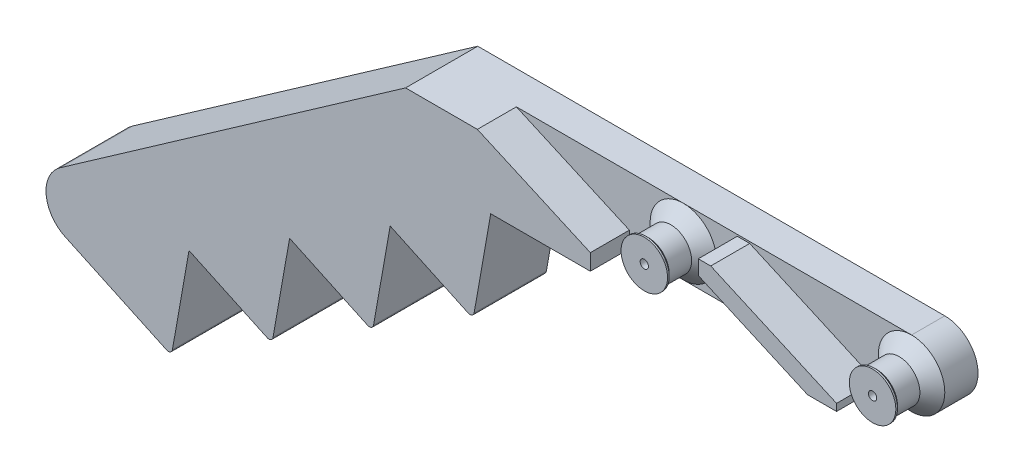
SolidWorks part; units mm, degrees
ref_plane "Alzado" through (0, 0, 0) normal (0, 0, 1) x (1, 0, 0)
ref_plane "Planta" through (0, 0, 0) normal (0, 1, 0) x (1, 0, 0)
ref_plane "Vista lateral" through (0, 0, 0) normal (1, 0, 0) x (0, 0, -1)
sketch "Sketch1" plane through (0, 0, 0) normal (0, 0, 1) x (1, 0, 0)
  line L0 (-27.5, 0) -> (27.5, 0) construction
  line L1 (-27.5, 4) -> (27.5, 4)
  line L2 (-27.5, -4) -> (27.5, -4)
  arc A0 (-27.5, 4) -> (-27.5, -4) centre (-27.5, 0) ccw
  arc A1 (27.5, -4) -> (27.5, 4) centre (27.5, 0) ccw
  point P3 (0, 0)
extrude "Boss-Extrude1" add sketch "Sketch1" along normal blind 4
sketch "Sketch2" plane through (0, 0, 4) normal (0, 0, 1) x (1, 0, 0)
  circle A0 centre (-27.5, 0) radius 4
extrude "Boss-Extrude2" add sketch "Sketch2" along normal blind 1.5
chamfer "Chamfer1" distance 1.5 angle 45 1 edges at (-23.5, 0, 5.5)
sketch "Sketch3" plane through (0, 0, 5.5) normal (0, 0, 1) x (1, 0, 0)
  circle A0 centre (-27.5, 0) radius 2.5
  circle A1 centre (-27.5, 0) radius 2.5 construction
extrude "Boss-Extrude3" add sketch "Sketch3" along normal blind 2
sketch "Sketch4" plane through (0, 0, 7.5) normal (0, 0, 1) x (1, 0, 0)
  circle A0 centre (-27.5, 0) radius 2.8
  circle A1 centre (-27.5, 0) radius 2.5 construction
extrude "Boss-Extrude4" add sketch "Sketch4" along normal blind 1.2
chamfer "Chamfer2" distance 1 angle 45 1 edges at (-24.7, 0, 7.5)
mirror "Mirror5" about plane through (0, 0, 0) normal (1, 0, 0) of "Boss-Extrude4", "Boss-Extrude3", "Boss-Extrude2"
chamfer "Chamfer3" distance 1.5 angle 45 1 edges at (23.5, 0, 5.5)
chamfer "Chamfer4" distance 1 angle 45 1 edges at (24.7, 0, 7.5)
ref_plane "Plane1" through (-13.75, 0, 0) normal (1, 0, 0) x (0, 0, -1)
mirror "Mirror6" about plane through (-13.75, 0, 0) normal (1, 0, 0) of "Boss-Extrude4", "Boss-Extrude3", "Boss-Extrude2"
chamfer "Chamfer5" distance 1 angle 45 1 edges at (-2.8, 0, 7.5)
chamfer "Chamfer6" distance 1.5 angle 45 1 edges at (-4, 0, 5.5)
sketch "Sketch5" plane through (0, 0, 0) normal (0, 0, -1) x (-1, 0, 0)
  circle A0 centre (-27.5, 0) radius 0.5
  circle A1 centre (0, 0) radius 0.5
  circle A2 centre (27.5, 0) radius 0.5
extrude "Cut-Extrude2" cut sketch "Sketch5" against normal blind 9.5
sketch "Sketch6" plane through (0, 0, 4) normal (0, 0, 1) x (1, 0, 0)
  line L2 (-6.5, -3.8) -> (-6.5, -2.0596)
  line L3 (-6.5, -2.0596) -> (-19.661, 3.8)
  line L5 (-19.661, 3.8) -> (-23.161, 3.8)
  line L6 (-23.161, 3.8) -> (-23.161, 2.9501)
  line L7 (-23.161, 2.9501) -> (-8, -3.8)
  line L8 (-8, -3.8) -> (-6.5, -3.8)
  line L9 (-27.5, -4) -> (0, -4) construction
  line L10 (0, 4) -> (-27.5, 4) construction
  dimension "D1" = 156
  dimension "D2" = 2.2
  dimension "D3" = 0.2
  dimension "D4" = 0.2
  dimension "D5" = 3.5
  dimension "D6" = 1.5
  dimension "D7" = 6.5
extrude "Boss-Extrude5" add sketch "Sketch6" along normal up to surface (4.7 mm away)
mirror "Mirror7" about plane through (0, 0, 0) normal (0, 1, 0) of "Boss-Extrude5"
sketch "Sketch7" plane through (0, 0, 8.7) normal (0, 0, 1) x (1, 0, 0)
  line L0 (-14.8544, 1.66) -> (-8.3443, -1.2385)
  line L1 (-13.8305, 1.2041) -> (-19.661, 3.8) construction
  line L2 (-6.5, -2.0596) -> (-11.126, 0) construction
  line L3 (-8.3443, -1.2385) -> (-4.9598, 1.7717)
  line L4 (-4.9598, 1.7717) -> (-5.6268, 5.2784)
  line L5 (-5.6268, 5.2784) -> (-14.8544, 1.66)
  line L6 (-17.0737, 0.2399) -> (-11.6017, -2.1964)
  line L7 (-23.161, 2.9501) -> (-16.5349, 0) construction
  line L8 (-13.8305, -1.2041) -> (-8, -3.8) construction
  line L9 (-11.6017, -2.1964) -> (-20.9225, -7.7318)
  line L10 (-20.9225, -7.7318) -> (-24.559, -3.6433)
  line L11 (-24.559, -3.6433) -> (-22.1459, -0.5196)
  line L12 (-22.1459, -0.5196) -> (-17.0737, 0.2399)
  line L13 (8.9056, 0.9886) -> (14.8337, -1.6507)
  line L14 (6.5, 2.0596) -> (11.126, 0) construction
  line L15 (13.8305, -1.2041) -> (19.661, -3.8) construction
  line L16 (14.8337, -1.6507) -> (7.5401, -4.9541)
  line L17 (7.5401, -4.9541) -> (5.0997, -4.3744)
  line L18 (5.0997, -4.3744) -> (5.0353, -0.6172)
  line L19 (5.0353, -0.6172) -> (8.9056, 0.9886)
  line L20 (11.9995, 2.0193) -> (18.9185, -1.0612)
  line L21 (13.8305, 1.2041) -> (8, 3.8) construction
  line L22 (23.161, -2.9501) -> (16.5349, 0) construction
  line L23 (18.9185, -1.0612) -> (24.031, 3.232)
  line L24 (24.031, 3.232) -> (23.4042, 6.2356)
  line L25 (23.4042, 6.2356) -> (16.1646, 4.7249)
  line L26 (16.1646, 4.7249) -> (11.9995, 2.0193)
extrude "Cut-Extrude5" cut sketch "Sketch7" against normal up to surface (4.7 mm away)
sketch "Sketch8" plane through (0, 0, 4) normal (0, 0, 1) x (1, 0, 0)
  line L27 (-6.5, -2.0596) -> (-20.1102, 4)
  line L28 (0, 4) -> (-27.5, 4) construction
  line L30 (-6.5, -2.0596) -> (-19.661, 3.8) construction
  line L31 (-20.1102, 4) -> (-28.7612, 4)
  line L32 (-28.7612, 4) -> (-70.3736, -25.1373)
  line L33 (-6.5, -2.0596) -> (-6.5, -4)
  line L34 (-27.5, -4) -> (0, -4) construction
  line L35 (-6.5, -4) -> (-18.5, -4)
  line L36 (-18.5, -4) -> (-20.5028, -15.3583)
  line L37 (-21.2065, -15.7246) -> (-30.6159, -11.3369)
  line L38 (-30.6159, -11.3369) -> (-32.6187, -22.6952)
  line L39 (-33.3224, -23.0615) -> (-42.7318, -18.6738)
  line L40 (-42.7318, -18.6738) -> (-44.7346, -30.0321)
  line L41 (-45.4383, -30.3985) -> (-54.8478, -26.0108)
  line L42 (-54.8478, -26.0108) -> (-56.8505, -37.3691)
  line L43 (-57.5543, -37.7354) -> (-69.7698, -32.0392)
  arc A10 (-27.5, 4) -> (-27.5, -4) centre (-27.5, 0) ccw construction
  arc A11 (-70.3736, -25.1373) -> (-69.7698, -32.0392) centre (-68.0793, -28.414) ccw
  arc A12 (-20.5028, -15.3583) -> (-21.2065, -15.7246) centre (-20.9952, -15.2715) cw
  arc A13 (-32.6187, -22.6952) -> (-33.3224, -23.0615) centre (-33.1111, -22.6084) cw
  arc A14 (-44.7346, -30.0321) -> (-45.4383, -30.3985) centre (-45.227, -29.9453) cw
  arc A15 (-56.8505, -37.3691) -> (-57.5543, -37.7354) centre (-57.3429, -37.2822) cw
  point P29 (-20.6159, -16)
  point P32 (-32.7318, -23.3369)
  point P35 (-44.8478, -30.6738)
  point P38 (-56.9637, -38.0108)
  dimension "D11" = 10
  dimension "D12" = 12
  dimension "D5" = 75
  dimension "D19" = 0.5
  dimension "D18" = 4
  dimension "D1" = 12
  dimension "D2" = 100
  dimension "D3" = 145
  dimension "D4" = 12
  dimension "D6" = 100
  dimension "D7" = 12
  dimension "D8" = 10
  dimension "D9" = 100
  dimension "D10" = 75
  dimension "D13" = 100
  dimension "D14" = 10
  dimension "D15" = 75
  dimension "D16" = 12
  dimension "D17" = 75
extrude "Boss-Extrude6" add sketch "Sketch8" along normal up to surface and the other way up to surface
equation "\"largo\"= 55"
equation "\"D1@Sketch1\"=\"largo\""
equation "\"ancho\"= 8"
equation "\"D2@Sketch1\"=\"ancho\""
equation "\"thick\" = 4"
equation "\"D1@Boss-Extrude1\"=\"thick\""
equation "\"D1@Sketch2\"=\"largo\"/2"
equation "\"thick_c\"= 1.5"
equation "\"c\"= 8"
equation "\"c1\"= 5.6"
equation "\"D2@Sketch2\"=\"c\""
equation "\"D1@Boss-Extrude2\"=\"thick_c\""
equation "\"alto_c\"= 2"
equation "\"D1@Boss-Extrude3\"=\"alto_c\""
equation "\"D1@Sketch4\"=\"c1\""
equation "\"c_mini\"= 1"
equation "\"D1@Sketch5\"=\"c_mini\""
equation "\"D2@Sketch5\"=\"largo\"/2"
equation "\"D3@Sketch5\"=\"c_mini\""
equation "\"D4@Sketch5\"=\"c_mini\""
equation "\"chan_1\"= 1.5"
equation "\"chan_2\"= 1"
equation "\"D1@Chamfer1\"=\"chan_1\""
equation "\"D1@Chamfer3\"=\"chan_1\""
equation "\"D1@Chamfer6\"=\"chan_1\""
